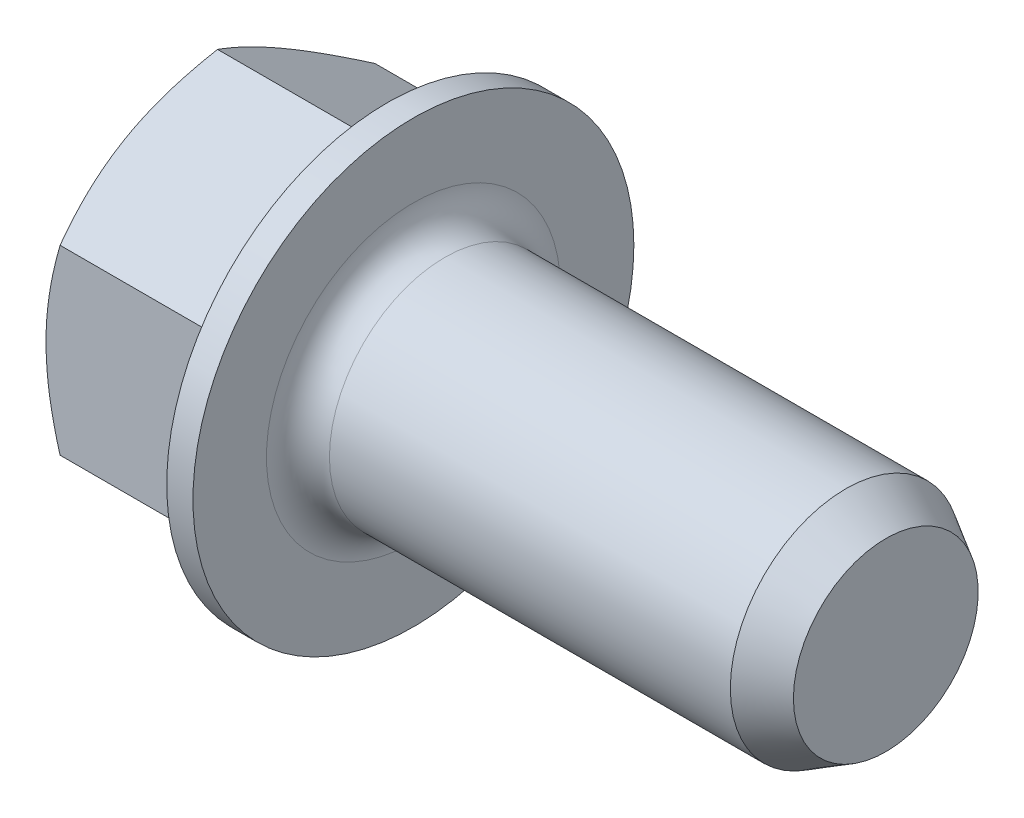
SolidWorks part; units mm, degrees
ref_plane "Front" through (0, 0, 0) normal (0, 0, 1) x (1, 0, 0)
ref_plane "Top" through (0, 0, 0) normal (0, 1, 0) x (1, 0, 0)
ref_plane "Right" through (0, 0, 0) normal (1, 0, 0) x (0, 0, -1)
sketch "Sketch1" plane through (0, 0, 0) normal (0, 0, 1) x (1, 0, 0)
  line L0 (0, 0) -> (0, 1.32)
  line L1 (0, 1.32) -> (1.75, 1.32)
  line L2 (2, 2.1) -> (2, 1.1)
  line L3 (1.75, 1.32) -> (1.75, 2.1)
  line L4 (2, 1.1) -> (6.5, 1.1)
  line L5 (6.5, 1.1) -> (6.5, 0)
  line L6 (6.5, 0) -> (0, 0)
  line L7 (13.1079, 0) -> (-2.2203, 0) construction
  line L8 (1.75, 2.1) -> (2, 2.1)
  dimension "da" = 2.64
  dimension "d" = 2.2
  dimension "k" = 2
  dimension "l" = 4.5
  dimension "c" = 0.25
  dimension "dc" = 4.2
revolve "Revolve1" add sketch "Sketch1" angle 360 about L7
sketch "Sketch2" plane through (0, 0, 0) normal (-1, 0, 0) x (0, 0, 1)
  line L1 (1.5, -0.866) -> (1.5, 0.866)
  line L2 (1.5, 0.866) -> (0, 1.7321)
  line L3 (0, 1.7321) -> (-1.5, 0.866)
  line L4 (-1.5, 0.866) -> (-1.5, -0.866)
  line L5 (-1.5, -0.866) -> (0, -1.7321)
  line L6 (0, -1.7321) -> (1.5, -0.866)
  circle A0 centre (0, 0) radius 1.5 construction
  dimension "s" = 3
extrude "Extrude1" add sketch "Sketch2" against normal blind 2
sketch "Sketch3" plane through (0, 0, 0) normal (0, 1, 0) x (1, 0, 0)
  line L0 (-0.866, 0) -> (7.7942, 15)
  line L2 (0, 0) -> (-2.2444, 0) construction
  line L5 (7.7942, 15) -> (-0.966, 15)
  line L6 (-0.866, 0) -> (-0.966, 0)
  line L7 (-0.966, 0) -> (-0.966, 15)
  dimension "D1" = 60
  dimension "D2" = 30
  dimension "D3" = 0.1
revolve "Cut-Revolve2" cut sketch "Sketch3" angle 360 about L2
sketch "Sketch4" plane through (0, 0, 0) normal (0, 0, 1) x (1, 0, 0)
  line L0 (0, 0) -> (1.9538, 0) construction
  line L1 (-0.2, 0) -> (-0.2, 1.2)
  line L2 (-0.2, 1.2) -> (0.85, 1.2)
  line L3 (0.85, 1.2) -> (0.85, 0)
  line L5 (1.75, 2.1) -> (1.75, -2.1) construction
  line L6 (0.85, 0) -> (-0.2, 0)
  line L7 (1.75, 2.1) -> (1.75, -2.1) construction
  dimension "D1" = 0.2
  dimension "D2" = 2.4
  dimension "k'" = 0.9
revolve "Cut-Revolve3" cut sketch "Sketch4" angle 360 about L0
chamfer "Chamfer1" distance 0.22 angle 60 1 edges at (6.5, 0, -1.1)
sketch "Sketch6" plane through (0, 0, 0) normal (0, 0, 1) x (1, 0, 0)
  line L0 (2.7155, 0.815) -> (2.2445, 0.815)
  line L1 (2.2445, 0.815) -> (2.08, 1.1)
  line L2 (2.7155, 0.815) -> (2.88, 1.1)
  line L3 (2.08, 1.1) -> (2.08, 1.35)
  line L4 (2.88, 1.1) -> (2.88, 1.35)
  line L5 (2.08, 1.35) -> (2.88, 1.35)
  line L6 (2.48, 0.815) -> (2.48, 0) construction
  line L7 (0, 0) -> (7.3035, 0) construction
  dimension "D1" = 2.2
  dimension "D2" = 60
  dimension "D3" = 0.25
  dimension "threadstart" = 2.48
  dimension "minordia" = 1.63
  dimension "advance" = 0.8
revolve "ThreadSchematic" [suppressed] cut sketch "Sketch6" angle 360 about L7
pattern_linear "ThdSchPat" [suppressed] count 6 spacing 0.8 along (-1, 0, 0)
sketch "Sketch5" plane through (0, 0, 0) normal (0, 0, 1) x (1, 0, 0)
  line L1 (6.5, 1.1) -> (6.5, 0) construction
  line L3 (3.5, -1.1) -> (4.7, -1.1) construction
  line L4 (0, 0) -> (6.648, 0) construction
  line L5 (6.5, 0) -> (4.7, -1.1)
  line L6 (6.5, 0) -> (6.7, 0)
  line L7 (6.7, 0) -> (6.7, -1.3)
  line L8 (6.7, -1.3) -> (4.7, -1.3)
  line L9 (4.7, -1.3) -> (4.7, -1.1)
  line L10 (4.7, -1.1) -> (6.8602, -1.1) construction
  dimension "D1" = 0.2
  dimension "y" = 2
  dimension "D3" = 0.2
  dimension "D4" = 2.2
revolve "EndCone" [suppressed] cut sketch "Sketch5" angle 360 about L4
fillet "Fillet1" radius 0.3 1 edges at (2, 0, -1.1)
fillet "Fillet2" radius 0.2 6 edges at (1.75, -1.299, -0.75) (1.75, 0, -1.5) (1.75, 1.299, -0.75) (1.75, -1.299, 0.75) (1.75, 0, 1.5) (1.75, 1.299, 0.75)
equation "\"minordia@sketch6\" = \"D2@ThreadCosmetic\""
equation "\"D1@Extrude1\" = \"k@Sketch1\""
equation "\"D2@Sketch4\" = \"s@Sketch2\" * 4 / 5"
equation "\"D1@Chamfer1\" = \"d@Sketch1\" / 10"
equation "\"threadstart@Sketch6\" = \"D1@Extrude1\"+(\"advance@Sketch6\"*0.6)"
equation "\"D1@ThdSchPat\" = int((\"l@Sketch1\"/\"advance@Sketch6\") + 0.8)"
equation "\"D3@ThdSchPat\" = \"advance@Sketch6\""
equation "\"D1@Sketch6\" = \"d@Sketch1\""
equation "\"D4@Sketch5\" = \"d@Sketch1\""
equation "\"da@Sketch1\" = \"d@Sketch1\"*1.2"
